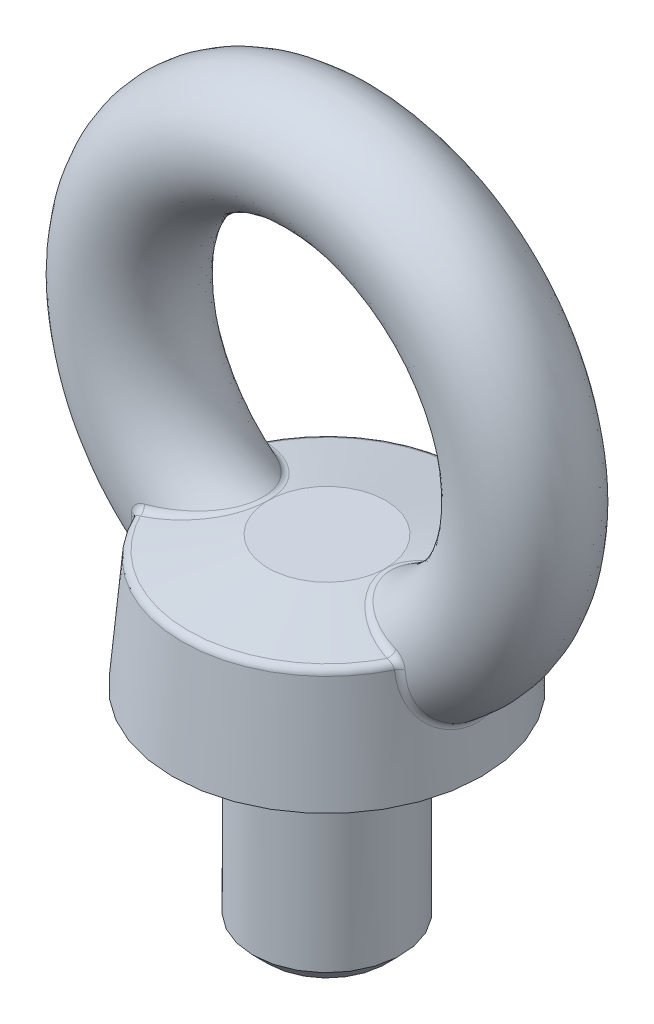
SolidWorks part; units mm, degrees
ref_plane "Front Plane" through (0, 0, 0) normal (0, 0, 1) x (1, 0, 0)
ref_plane "Top Plane" through (0, 0, 0) normal (0, 1, 0) x (1, 0, 0)
ref_plane "Right Plane" through (0, 0, 0) normal (1, 0, 0) x (0, 0, -1)
sketch "Sketch1" plane through (0, 0, 0) normal (0, 0, 1) x (1, 0, 0)
  ellipse E0 centre (0, 84) end of major axis (0, 0) minor radius 83
  dimension "D1" = 166
  dimension "D2" = 168
sketch "Sketch2" plane through (0, 0, 0) normal (1, 0, 0) x (0, 0, -1)
  line L3 (0, 168) -> (0, 0) construction
  circle A0 centre (0, 19) radius 19
  point P5 (0, 0)
sweep "Sweep1" add profiles "Sketch2" path "Sketch1"
sketch "Sketch3" plane through (0, 0, 0) normal (1, 0, 0) x (0, 0, -1)
  line L0 (0, 0) -> (-50, 0)
  line L1 (-50, 0) -> (-46.6754, 38)
  line L2 (-46.6754, 38) -> (-19, 42.8799)
  line L3 (-19, 42.8799) -> (0, 42.8799)
  line L4 (0, 42.8799) -> (0, 0)
revolve "Revolve1" add sketch "Sketch3" angle 360 about L4
fillet "Fillet1" radius 2.4 6 edges at (20.1207, 42.6525, -2.6121) (48.6069, 15.9133, -0.2953) (-20.1207, 42.6525, 2.6121) (-48.6069, 15.9133, 0.2953) (0, 38, -46.6754) (0, 38, 46.6754)
sketch "Sketch4" plane through (0, 0, 0) normal (0, -1, 0) x (1, 0, 0)
  circle A0 centre (0, 0) radius 24
  dimension "D1" = 48
extrude "Extrude1" add sketch "Sketch4" along normal blind 68
chamfer "Chamfer1" distance 5 angle 45 1 edges at (0, -68, -24)
sketch "Sketch5" plane through (0, 0, 0) normal (1, 0, 0) x (0, 0, -1)
  line L0 (-24, 0) -> (-24, -13.6603)
  line L1 (-24, 0) -> (-24, -63) construction
  line L2 (-19, -5) -> (-24, -13.6603)
  line L3 (-19, -5) -> (-19, -2.5)
  line L4 (-21.5, 0) -> (-24, 0)
  line L5 (-21.5, -2.5) -> (-19, -2.5) construction
  arc A1 (-19, -2.5) -> (-21.5, 0) centre (-21.5, -2.5) ccw
  point P0 (-19, -68)
  dimension "D1" = 30
revolve "Cut-Revolve1" cut sketch "Sketch5" angle 360 about axis through (0, -68, 0) along (0, 1, 0)
equation "\"D4@Sketch3\" = \"D1@Sketch2\""
equation "\"D5@Sketch3\" = \"D1@Sketch2\"/2"
